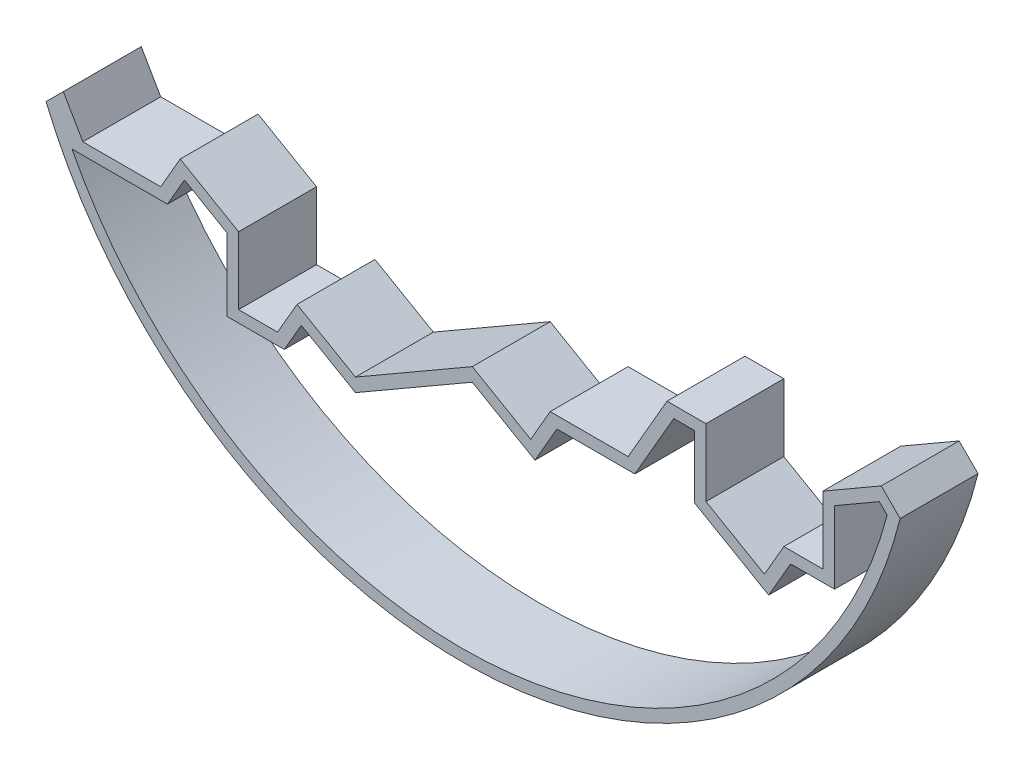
SolidWorks part; units mm, degrees
ref_plane "Přední rovina" through (0, 0, 0) normal (0, 0, 1) x (1, 0, 0)
ref_plane "Horní rovina" through (0, 0, 0) normal (0, 1, 0) x (1, 0, 0)
ref_plane "Pravá rovina" through (0, 0, 0) normal (1, 0, 0) x (0, 0, -1)
sketch "Skica1" plane through (0, 0, 0) normal (0, 0, 1) x (1, 0, 0)
  line L0 (-181.4607, 28.8101) -> (-176.4607, 20.1499)
  line L1 (-176.4607, 20.1499) -> (-156.4607, 20.1499)
  line L2 (-156.4607, 20.1499) -> (-151.4607, 28.8101)
  line L3 (-151.4607, 28.8101) -> (-136.4607, 20.1499)
  line L4 (-136.4607, 20.1499) -> (-136.4607, 2.8294)
  line L5 (-136.4607, 2.8294) -> (-126.4607, 2.8294)
  line L6 (-126.4607, 2.8294) -> (-121.4607, 11.4896)
  line L7 (-121.4607, 11.4896) -> (-106.4607, 2.8294)
  line L8 (-106.4607, 2.8294) -> (-76.4607, 20.1499)
  line L9 (-76.4607, 20.1499) -> (-61.4607, 11.4896)
  line L10 (-61.4607, 11.4896) -> (-56.4607, 20.1499)
  line L11 (-56.4607, 20.1499) -> (-36.4607, 20.1499)
  line L12 (-36.4607, 20.1499) -> (-26.4607, 37.4704)
  line L13 (-26.4607, 37.4704) -> (-16.4607, 37.4704)
  line L14 (-16.4607, 37.4704) -> (-16.4607, 20.1499)
  line L15 (-16.4607, 20.1499) -> (-1.4607, 11.4896)
  line L16 (-1.4607, 11.4896) -> (3.5393, 20.1499)
  line L17 (3.5393, 20.1499) -> (13.5393, 20.1499)
  line L18 (13.5393, 20.1499) -> (13.5393, 37.4704)
  line L19 (13.5393, 37.4704) -> (28.5393, 46.1306)
  line L20 (-181.4607, 28.8101) -> (-185.9171, 24.3537)
  line L21 (28.5393, 46.1306) -> (33.3822, 41.2877)
  line L22 (-139.4607, 18.4178) -> (-139.4607, -0.1706)
  line L23 (-139.4607, -0.1706) -> (-124.7286, -0.1706)
  line L24 (-124.7286, -0.1706) -> (-120.3626, 7.3915)
  line L25 (-120.3626, 7.3915) -> (-106.4607, -0.6347)
  line L26 (-106.4607, -0.6347) -> (-76.4607, 16.6858)
  line L27 (-76.4607, 16.6858) -> (-60.3626, 7.3915)
  line L28 (-60.3626, 7.3915) -> (-54.7286, 17.1499)
  line L29 (-54.7286, 17.1499) -> (-34.7286, 17.1499)
  line L30 (-34.7286, 17.1499) -> (-24.7286, 34.4704)
  line L31 (-24.7286, 34.4704) -> (-19.4607, 34.4704)
  line L32 (-19.4607, 34.4704) -> (-19.4607, 18.4178)
  line L33 (-19.4607, 18.4178) -> (-0.3626, 7.3915)
  line L34 (-0.3626, 7.3915) -> (5.2714, 17.1499)
  line L35 (5.2714, 17.1499) -> (16.5393, 17.1499)
  line L36 (16.5393, 17.1499) -> (16.5393, 35.7383)
  line L37 (16.5393, 35.7383) -> (28.0458, 42.3816)
  line L38 (28.0458, 42.3816) -> (30.0543, 40.373)
  line L40 (-178.1927, 17.1499) -> (-154.7286, 17.1499) construction
  line L41 (-179.2481, 17.1499) -> (-154.7286, 17.1499)
  line L42 (-154.7286, 17.1499) -> (-150.3626, 24.712)
  line L43 (-150.3626, 24.712) -> (-139.4607, 18.4178)
  line L44 (-182.1039, 23.9242) -> (-178.1927, 17.1499) construction
  line L45 (-182.1039, 23.9242) -> (-182.3602, 23.668) construction
  arc A0 (-179.2481, 17.1499) -> (30.0543, 40.373) centre (-79.06, 68.9861) ccw
  arc A1 (-185.9171, 24.3537) -> (33.3822, 41.2877) centre (-79.06, 68.9861) ccw
  arc A2 (-182.3602, 23.668) -> (30.0543, 40.373) centre (-79.06, 68.9861) ccw construction
  dimension "D1" = 3
extrude "Přidat vysunutím1" add sketch "Skica1" along normal blind 20
